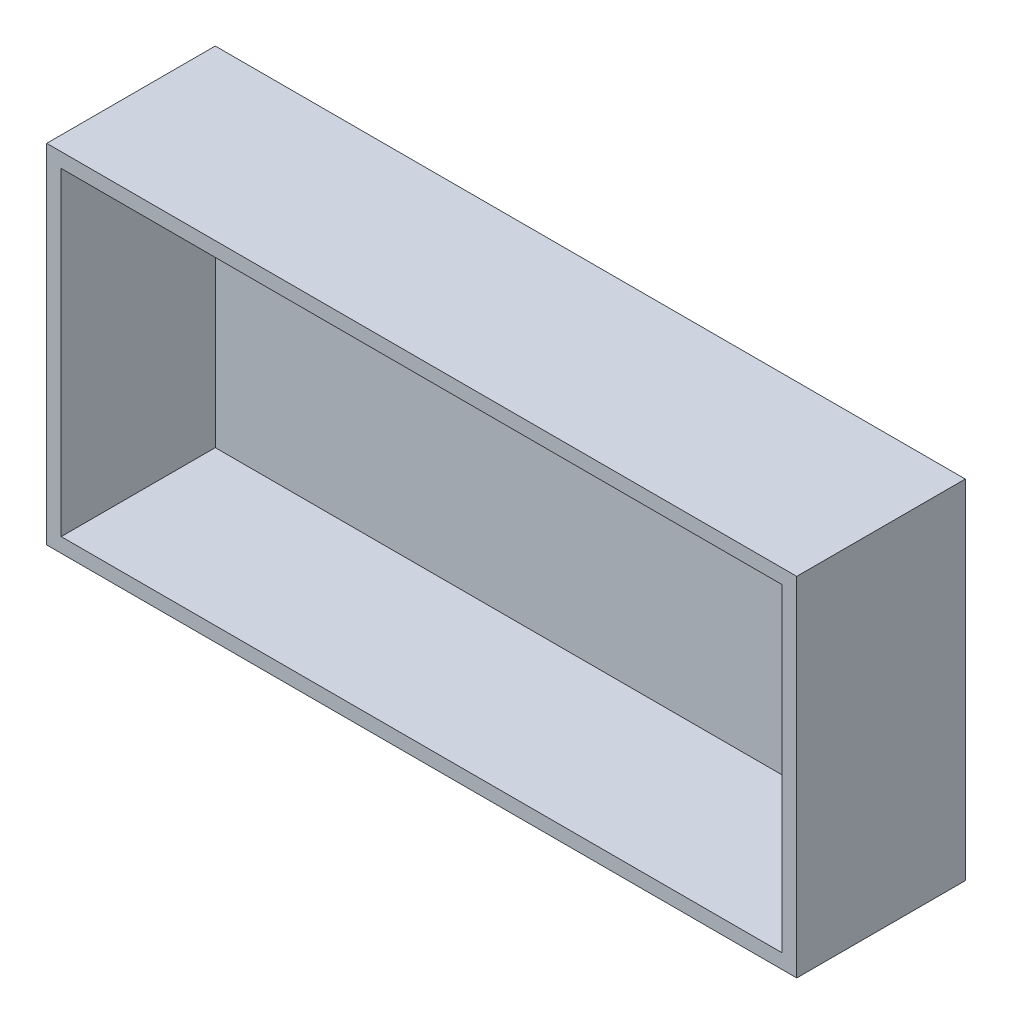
SolidWorks part; units mm, degrees
ref_plane "정면" through (0, 0, 0) normal (0, 0, 1) x (1, 0, 0)
ref_plane "윗면" through (0, 0, 0) normal (0, 1, 0) x (1, 0, 0)
ref_plane "우측면" through (0, 0, 0) normal (1, 0, 0) x (0, 0, -1)
sketch "스케치1" plane through (0, 0, 0) normal (0, 0, 1) x (1, 0, 0)
  line L1 (-25.875, -12) -> (25.875, -12)
  line L2 (-25.875, -12) -> (-25.875, 12)
  line L3 (-25.875, 12) -> (25.875, 12)
  line L4 (25.875, -12) -> (25.875, 12)
  line L5 (-25.875, -12) -> (25.875, 12) construction
  line L6 (-25.875, 12) -> (25.875, -12) construction
  point P0 (0, 0)
  dimension "D1" = 51.75
  dimension "D2" = 24
extrude "보스-돌출1" add sketch "스케치1" along normal blind 11.63
sketch "스케치2" plane through (0, 0, 11.63) normal (0, 0, 1) x (1, 0, 0)
  line L8 (24.875, -11) -> (24.875, 11)
  line L9 (24.875, 11) -> (-24.875, 11)
  line L10 (-24.875, 11) -> (-24.875, -11)
  line L11 (-24.875, -11) -> (24.875, -11)
  line L12 (24.875, -11) -> (24.875, 11)
  line L13 (24.875, 11) -> (-24.875, 11)
  line L14 (-24.875, 11) -> (-24.875, -11)
  line L15 (-24.875, -11) -> (24.875, -11)
  dimension "D1" = 1
extrude "컷-돌출1" cut sketch "스케치2" against normal offset from surface (10.63 mm away) 1
